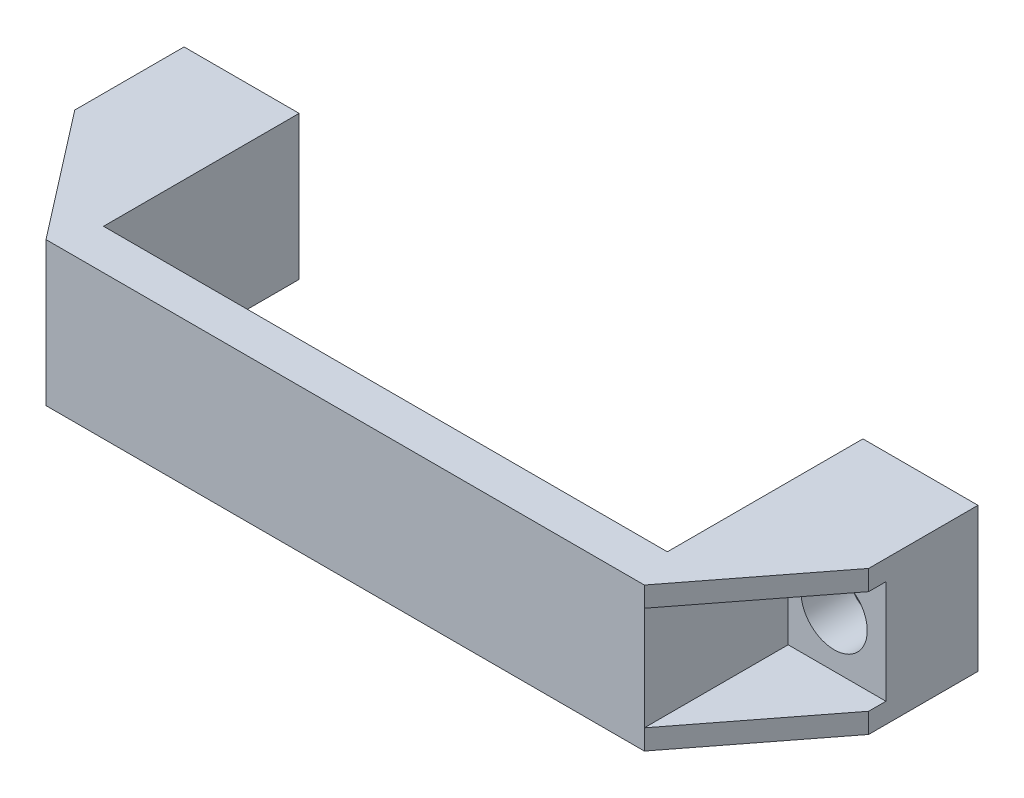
SolidWorks part; units mm, degrees
ref_plane "前视基准面" through (0, 0, 0) normal (0, 0, 1) x (1, 0, 0)
ref_plane "上视基准面" through (0, 0, 0) normal (0, 1, 0) x (1, 0, 0)
ref_plane "右视基准面" through (0, 0, 0) normal (1, 0, 0) x (0, 0, -1)
sketch "草图1" plane through (0, 0, 0) normal (0, 0, 1) x (1, 0, 0)
  line L1 (-69, 12.5) -> (69, 12.5)
  line L2 (-69, 12.5) -> (-69, -12.5)
  line L3 (-69, -12.5) -> (69, -12.5)
  line L4 (69, 12.5) -> (69, -12.5)
  dimension "D1" = 138
  dimension "D2" = 25
  dimension "D3" = 69
extrude "凸台-拉伸1" add sketch "草图1" along normal mid plane 41
sketch "草图2" plane through (0, -12.5, 0) normal (0, -1, 0) x (1, 0, 0)
  line L0 (-69, -20.5) -> (69, -20.5) construction
  line L1 (-49, 13.5) -> (49, 13.5)
  line L2 (-49, 13.5) -> (-49, -20.5)
  line L3 (-49, -20.5) -> (49, -20.5)
  line L4 (49, 13.5) -> (49, -20.5)
  line L5 (-69, 20.5) -> (-69, -20.5) construction
  dimension "D1" = 98
  dimension "D2" = 20
  dimension "D3" = 34
extrude "切除-拉伸1" cut sketch "草图2" against normal through all
sketch "草图3" plane through (0, -12.5, 0) normal (0, -1, 0) x (1, 0, 0)
  line L0 (-52, 20.5) -> (-69, 20.5)
  line L1 (-69, 20.5) -> (69, 20.5) construction
  line L2 (-69, 20.5) -> (-69, -1.5)
  line L3 (-69, 20.5) -> (-69, -20.5) construction
  line L4 (-69, -1.5) -> (-52, 20.5)
  line L5 (0, 20.5) -> (0, 13.5) construction
  line L6 (49, 13.5) -> (-49, 13.5) construction
  line L7 (69, -1.5) -> (52, 20.5)
  line L8 (69, 20.5) -> (69, -1.5)
  line L9 (52, 20.5) -> (69, 20.5)
  dimension "D1" = 17
  dimension "D2" = 22
extrude "切除-拉伸2" cut sketch "草图3" against normal through all
sketch "草图4" plane through (0, 0, -20.5) normal (0, 0, -1) x (-1, 0, 0)
  circle A0 centre (-60, 0) radius 3.25
  circle A1 centre (60, 0) radius 3.25
  dimension "D1" = 6.5
  dimension "D2" = 6.5
  dimension "D3" = 120
  dimension "D4" = 60
extrude "切除-拉伸3" cut sketch "草图4" against normal through all
sketch "草图5" plane through (0, 0, 20.5) normal (0, 0, 1) x (1, 0, 0)
  line L0 (-69, 12.5) -> (-69, -12.5) construction
  line L1 (-69, 9) -> (-52, 9)
  line L2 (-69, 9) -> (-69, -9)
  line L3 (-69, -9) -> (-52, -9)
  line L4 (-52, 9) -> (-52, -9)
  line L5 (-69, 12.5) -> (-52, 12.5) construction
  line L6 (-69, -12.5) -> (-52, -12.5) construction
  dimension "D1" = 17
  dimension "D2" = 3.5
  dimension "D3" = 3.5
extrude "切除-拉伸4" cut sketch "草图5" against normal blind 25
mirror "镜向1" about plane through (0, 0, 0) normal (1, 0, 0) of "切除-拉伸4"
sketch "草图6" plane through (0, 0, -4.5) normal (0, 0, 1) x (1, 0, 0)
  circle A0 centre (-60, 0) radius 5.75
  circle A1 centre (60, 0) radius 5.75
extrude "切除-拉伸5" cut sketch "草图6" against normal blind 8
